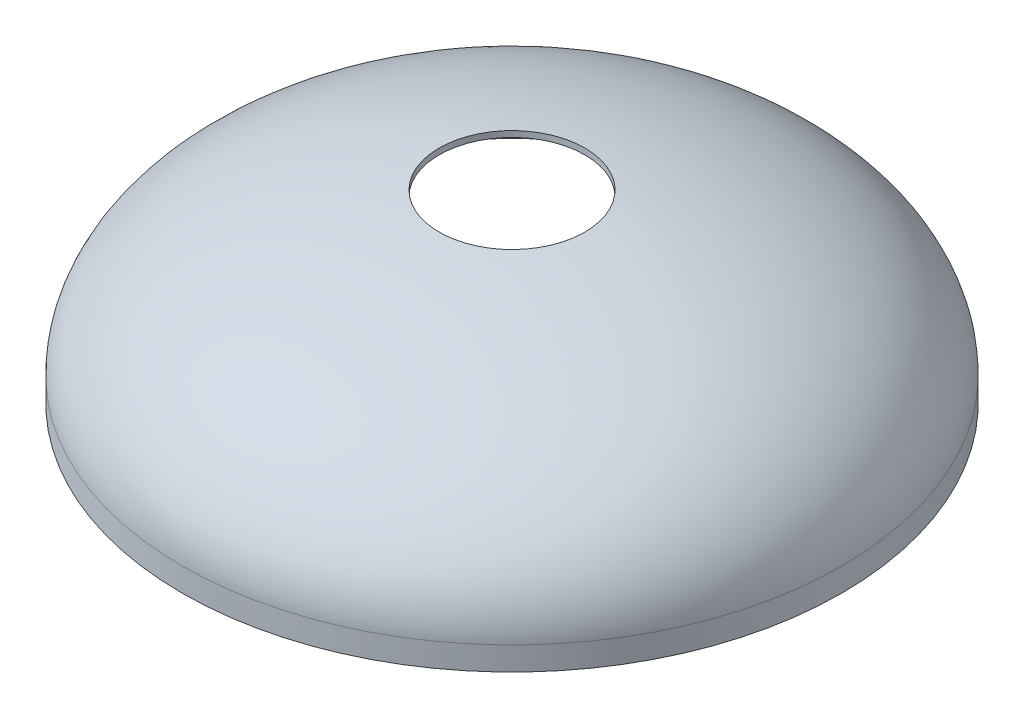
SolidWorks part; units mm, degrees
ref_plane "Front" through (0, 0, 0) normal (0, 0, 1) x (1, 0, 0)
ref_plane "Top" through (0, 0, 0) normal (0, 1, 0) x (1, 0, 0)
ref_plane "Right" through (0, 0, 0) normal (1, 0, 0) x (0, 0, -1)
sketch "Sketch1" plane through (0, 0, 0) normal (0, 0, 1) x (1, 0, 0)
  line L0 (-600, 0) -> (711.2, 0) construction
  line L1 (0, 355.6) -> (0, -262.0882) construction
  line L2 (711.2, 0) -> (711.2, -50.8)
  line L3 (711.2, -50.8) -> (0, -50.8)
  line L4 (0, -50.8) -> (0, 355.6)
  line L5 (0, 441.3239) -> (0, -172.0994) construction
  ellipse E0 centre (0, 0) end of major axis (-711.2, 0) minor radius 355.6 (711.2, 0) -> (0, 355.6) ccw
revolve "Revolve1" add sketch "Sketch1" angle 360 about L5
shell "Shell1" thickness 12.7
sketch "Sketch2" plane through (0, 0, 0) normal (0, 0, 1) x (1, 0, 0)
  line L0 (700.0875, -50.8) -> (711.2, -42.2731)
  line L1 (-711.2, -50.8) -> (711.2, -50.8) construction
  line L2 (711.2, -50.8) -> (711.2, 0) construction
  line L3 (711.2, -42.2731) -> (711.2, -50.8)
  line L4 (711.2, -50.8) -> (700.0875, -50.8)
  line L5 (0, 368.2765) -> (0, -140.1425) construction
  dimension "D1" = 1.5875
  dimension "D2" = 37.5
revolve "Cut-Revolve1" [suppressed] cut sketch "Sketch2" angle 360 about L5
sketch "Sketch4" plane through (0, 0, 0) normal (0, 1, 0) x (1, 0, 0)
  circle A0 centre (0, 0) radius 157.1625
  dimension "D1" = 314.325
extrude "Nozzle 1" cut sketch "Sketch4" along normal blind 456.946
ref_point "Point1"
equation "\"D2@Sketch1\" = \"D1@Sketch1@Shell 1<1>.Part@Vessel section 1<4>.Assembly\" / 2"
equation "\"D3@Sketch1\" = \"D2@Sketch1\"/2"
